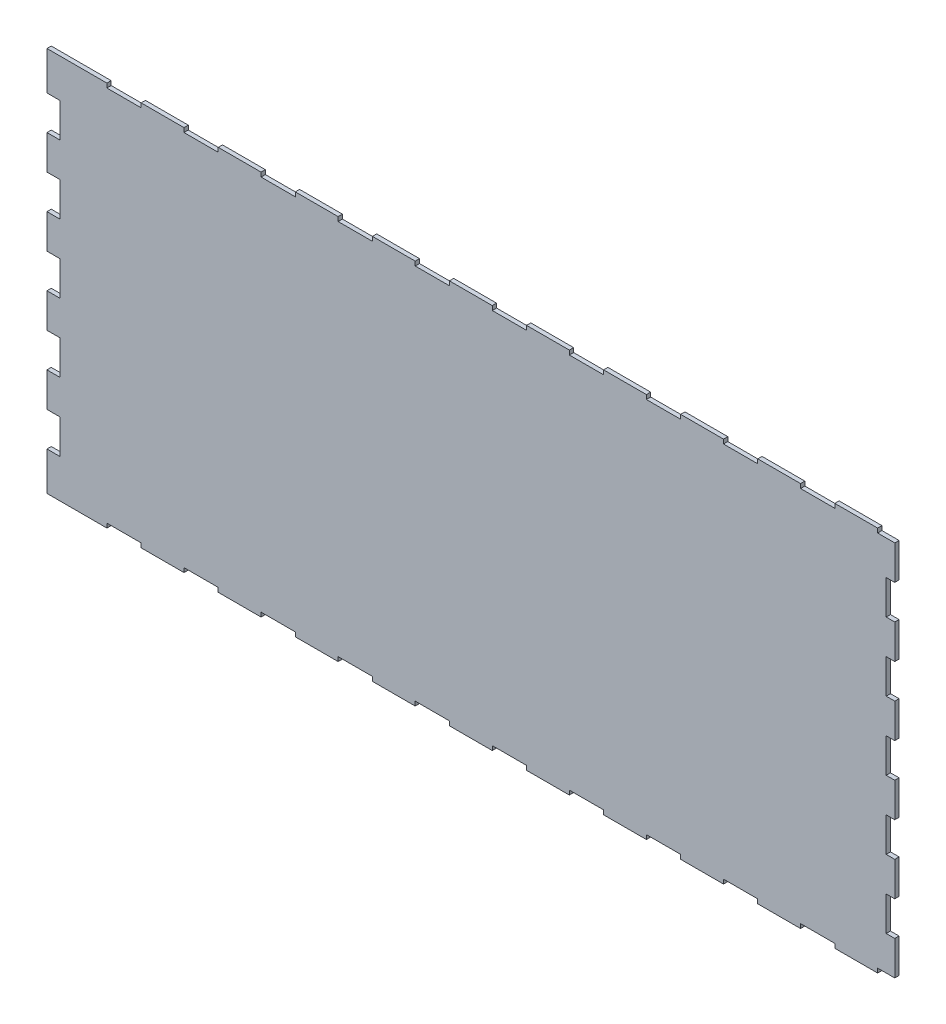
SolidWorks part; units mm, degrees
ref_plane "Front Plane" through (0, 0, 0) normal (0, 0, 1) x (1, 0, 0)
ref_plane "Top Plane" through (0, 0, 0) normal (0, 1, 0) x (1, 0, 0)
ref_plane "Right Plane" through (0, 0, 0) normal (1, 0, 0) x (0, 0, -1)
sketch "Model" plane through (0, 0, 0) normal (0, 0, 1) x (1, 0, 0)
  line L0 (900, 180) -> (885, 180)
  line L1 (885, 140) -> (885, 180)
  line L2 (900, 140) -> (885, 140)
  line L3 (900, 100) -> (900, 140)
  line L4 (900, 100) -> (885, 100)
  line L5 (885, 60) -> (885, 100)
  line L6 (900, 60) -> (885, 60)
  line L7 (900, 20) -> (900, 60)
  line L8 (900, 20) -> (885, 20)
  line L9 (885, -20) -> (885, 20)
  line L10 (900, -20) -> (885, -20)
  line L11 (900, -60) -> (900, -20)
  line L12 (900, -60) -> (885, -60)
  line L13 (885, -100) -> (885, -60)
  line L14 (900, -100) -> (885, -100)
  line L15 (900, -140) -> (900, -100)
  line L16 (900, -140) -> (885, -140)
  line L17 (885, -180) -> (885, -140)
  line L18 (900, -180) -> (885, -180)
  line L19 (900, -225) -> (900, -180)
  line L20 (900, -225) -> (830, -225)
  line L21 (830, -225) -> (830, -220)
  line L22 (830, -220) -> (790, -220)
  line L23 (790, -220) -> (790, -225)
  line L24 (790, -225) -> (740, -225)
  line L25 (740, -225) -> (740, -220)
  line L26 (740, -220) -> (700, -220)
  line L27 (700, -220) -> (700, -225)
  line L28 (700, -225) -> (650, -225)
  line L29 (650, -225) -> (650, -220)
  line L30 (650, -220) -> (610, -220)
  line L31 (610, -220) -> (610, -225)
  line L32 (610, -225) -> (560, -225)
  line L33 (560, -225) -> (560, -220)
  line L34 (560, -220) -> (520, -220)
  line L35 (520, -220) -> (520, -225)
  line L36 (520, -225) -> (470, -225)
  line L37 (470, -225) -> (470, -220)
  line L38 (470, -220) -> (430, -220)
  line L39 (430, -220) -> (430, -225)
  line L40 (430, -225) -> (380, -225)
  line L41 (380, -225) -> (380, -220)
  line L42 (380, -220) -> (340, -220)
  line L43 (340, -220) -> (340, -225)
  line L44 (340, -225) -> (290, -225)
  line L45 (290, -225) -> (290, -220)
  line L46 (290, -220) -> (250, -220)
  line L47 (250, -220) -> (250, -225)
  line L48 (250, -225) -> (200, -225)
  line L49 (200, -225) -> (200, -220)
  line L50 (200, -220) -> (160, -220)
  line L51 (160, -220) -> (160, -225)
  line L52 (160, -225) -> (110, -225)
  line L53 (110, -225) -> (110, -220)
  line L54 (110, -220) -> (70, -220)
  line L55 (70, -220) -> (70, -225)
  line L56 (70, -225) -> (20, -225)
  line L57 (20, -225) -> (20, -220)
  line L58 (20, -220) -> (-20, -220)
  line L59 (-20, -220) -> (-20, -225)
  line L60 (-20, -225) -> (-70, -225)
  line L61 (-70, -225) -> (-70, -220)
  line L62 (-70, -220) -> (-110, -220)
  line L63 (-110, -220) -> (-110, -225)
  line L64 (-110, -225) -> (-160, -225)
  line L65 (-160, -225) -> (-160, -220)
  line L66 (-160, -220) -> (-200, -220)
  line L67 (-200, -220) -> (-200, -225)
  line L68 (-200, -225) -> (-250, -225)
  line L69 (-250, -225) -> (-250, -220)
  line L70 (-250, -220) -> (-290, -220)
  line L71 (-290, -220) -> (-290, -225)
  line L72 (-290, -225) -> (-340, -225)
  line L73 (-340, -225) -> (-340, -220)
  line L74 (-340, -220) -> (-380, -220)
  line L75 (-380, -220) -> (-380, -225)
  line L76 (-380, -225) -> (-430, -225)
  line L77 (-430, -225) -> (-430, -220)
  line L78 (-430, -220) -> (-470, -220)
  line L79 (-470, -220) -> (-470, -225)
  line L80 (-470, -225) -> (-520, -225)
  line L81 (-520, -225) -> (-520, -220)
  line L82 (-520, -220) -> (-560, -220)
  line L83 (-560, -220) -> (-560, -225)
  line L84 (-560, -225) -> (-610, -225)
  line L85 (-610, -225) -> (-610, -220)
  line L86 (-610, -220) -> (-650, -220)
  line L87 (-650, -220) -> (-650, -225)
  line L88 (-650, -225) -> (-700, -225)
  line L89 (-700, -225) -> (-700, -220)
  line L90 (-700, -220) -> (-740, -220)
  line L91 (-740, -220) -> (-740, -225)
  line L92 (-740, -225) -> (-790, -225)
  line L93 (-790, -225) -> (-790, -220)
  line L94 (-790, -220) -> (-830, -220)
  line L95 (-830, -220) -> (-830, -225)
  line L96 (-830, -225) -> (-900, -225)
  line L97 (-900, -225) -> (-900, -180)
  line L98 (-900, -180) -> (-885, -180)
  line L99 (-885, -180) -> (-885, -140)
  line L100 (-900, -140) -> (-885, -140)
  line L101 (-900, -140) -> (-900, -100)
  line L102 (-900, -100) -> (-885, -100)
  line L103 (-885, -100) -> (-885, -60)
  line L104 (-900, -60) -> (-885, -60)
  line L105 (-900, -60) -> (-900, -20)
  line L106 (-900, -20) -> (-885, -20)
  line L107 (-885, -20) -> (-885, 20)
  line L108 (-900, 20) -> (-885, 20)
  line L109 (-900, 20) -> (-900, 60)
  line L110 (-900, 60) -> (-885, 60)
  line L111 (-885, 60) -> (-885, 100)
  line L112 (-900, 100) -> (-885, 100)
  line L113 (-900, 100) -> (-900, 140)
  line L114 (-900, 140) -> (-885, 140)
  line L115 (-885, 140) -> (-885, 180)
  line L116 (-900, 180) -> (-885, 180)
  line L117 (-900, 180) -> (-900, 225)
  line L118 (-830, 225) -> (-900, 225)
  line L119 (-830, 225) -> (-830, 220)
  line L120 (-790, 220) -> (-830, 220)
  line L121 (-790, 225) -> (-790, 220)
  line L122 (-740, 225) -> (-790, 225)
  line L123 (-740, 225) -> (-740, 220)
  line L124 (-700, 220) -> (-740, 220)
  line L125 (-700, 225) -> (-700, 220)
  line L126 (-650, 225) -> (-700, 225)
  line L127 (-650, 225) -> (-650, 220)
  line L128 (-610, 220) -> (-650, 220)
  line L129 (-610, 225) -> (-610, 220)
  line L130 (-560, 225) -> (-610, 225)
  line L131 (-560, 225) -> (-560, 220)
  line L132 (-520, 220) -> (-560, 220)
  line L133 (-520, 225) -> (-520, 220)
  line L134 (-470, 225) -> (-520, 225)
  line L135 (-470, 225) -> (-470, 220)
  line L136 (-430, 220) -> (-470, 220)
  line L137 (-430, 225) -> (-430, 220)
  line L138 (-380, 225) -> (-430, 225)
  line L139 (-380, 225) -> (-380, 220)
  line L140 (-340, 220) -> (-380, 220)
  line L141 (-340, 225) -> (-340, 220)
  line L142 (-290, 225) -> (-340, 225)
  line L143 (-290, 225) -> (-290, 220)
  line L144 (-250, 220) -> (-290, 220)
  line L145 (-250, 225) -> (-250, 220)
  line L146 (-200, 225) -> (-250, 225)
  line L147 (-200, 225) -> (-200, 220)
  line L148 (-160, 220) -> (-200, 220)
  line L149 (-160, 225) -> (-160, 220)
  line L150 (-110, 225) -> (-160, 225)
  line L151 (-110, 225) -> (-110, 220)
  line L152 (-70, 220) -> (-110, 220)
  line L153 (-70, 225) -> (-70, 220)
  line L154 (-20, 225) -> (-70, 225)
  line L155 (-20, 225) -> (-20, 220)
  line L156 (20, 220) -> (-20, 220)
  line L157 (20, 225) -> (20, 220)
  line L158 (70, 225) -> (20, 225)
  line L159 (70, 225) -> (70, 220)
  line L160 (110, 220) -> (70, 220)
  line L161 (110, 225) -> (110, 220)
  line L162 (160, 225) -> (110, 225)
  line L163 (160, 225) -> (160, 220)
  line L164 (200, 220) -> (160, 220)
  line L165 (200, 225) -> (200, 220)
  line L166 (250, 225) -> (200, 225)
  line L167 (250, 225) -> (250, 220)
  line L168 (290, 220) -> (250, 220)
  line L169 (290, 225) -> (290, 220)
  line L170 (340, 225) -> (290, 225)
  line L171 (340, 225) -> (340, 220)
  line L172 (380, 220) -> (340, 220)
  line L173 (380, 225) -> (380, 220)
  line L174 (430, 225) -> (380, 225)
  line L175 (430, 225) -> (430, 220)
  line L176 (470, 220) -> (430, 220)
  line L177 (470, 225) -> (470, 220)
  line L178 (520, 225) -> (470, 225)
  line L179 (520, 225) -> (520, 220)
  line L180 (560, 220) -> (520, 220)
  line L181 (560, 225) -> (560, 220)
  line L182 (610, 225) -> (560, 225)
  line L183 (610, 225) -> (610, 220)
  line L184 (650, 220) -> (610, 220)
  line L185 (650, 225) -> (650, 220)
  line L186 (700, 225) -> (650, 225)
  line L187 (700, 225) -> (700, 220)
  line L188 (740, 220) -> (700, 220)
  line L189 (740, 225) -> (740, 220)
  line L190 (790, 225) -> (740, 225)
  line L191 (790, 225) -> (790, 220)
  line L192 (830, 220) -> (790, 220)
  line L193 (830, 225) -> (830, 220)
  line L194 (900, 225) -> (830, 225)
  line L195 (900, 180) -> (900, 225)
extrude "Boss-Extrude1" add sketch "Model" along normal blind 5
sketch "Sketch1" plane through (0, 0, 5) normal (0, 0, 1) x (1, 0, 0)
  line L0 (90, 220) -> (90, 180)
  line L1 (90, 140) -> (90, 100)
  line L2 (90, 220) -> (1149.9354, 540.8325)
  line L3 (0, 202.5) -> (0, 48.6535) construction
  line L4 (110, 220) -> (70, 220) construction
  line L5 (70, -220) -> (110, -220) construction
  line L6 (1149.9354, 540.8325) -> (1000.8876, -705.749)
  line L7 (90, 180) -> (80, 180)
  line L9 (90, 140) -> (80, 140)
  line L10 (80, 180) -> (80, 140)
  line L11 (1000.8876, -705.749) -> (90, -220)
  line L13 (90, 60) -> (80, 60)
  line L14 (80, 100) -> (80, 60)
  line L15 (90, 100) -> (80, 100)
  line L16 (90, -20) -> (80, -20)
  line L17 (80, 20) -> (80, -20)
  line L18 (90, 20) -> (80, 20)
  line L19 (90, -100) -> (80, -100)
  line L20 (80, -60) -> (80, -100)
  line L21 (90, -60) -> (80, -60)
  line L22 (90, -180) -> (80, -180)
  line L23 (80, -140) -> (80, -180)
  line L24 (90, -140) -> (80, -140)
  line L25 (90, 60) -> (90, 20)
  line L26 (90, -20) -> (90, -60)
  line L27 (90, -100) -> (90, -140)
  line L28 (90, -180) -> (90, -220)
  point P13 (1000.8876, -705.749)
  point P32 (1149.9354, 540.8325)
  dimension "D1" = 40
  dimension "D2" = 40
  dimension "D3" = 10
  dimension "D5" = 40
  dimension "D4" = 5
extrude "Cut-Extrude1" cut sketch "Sketch1" against normal through all
